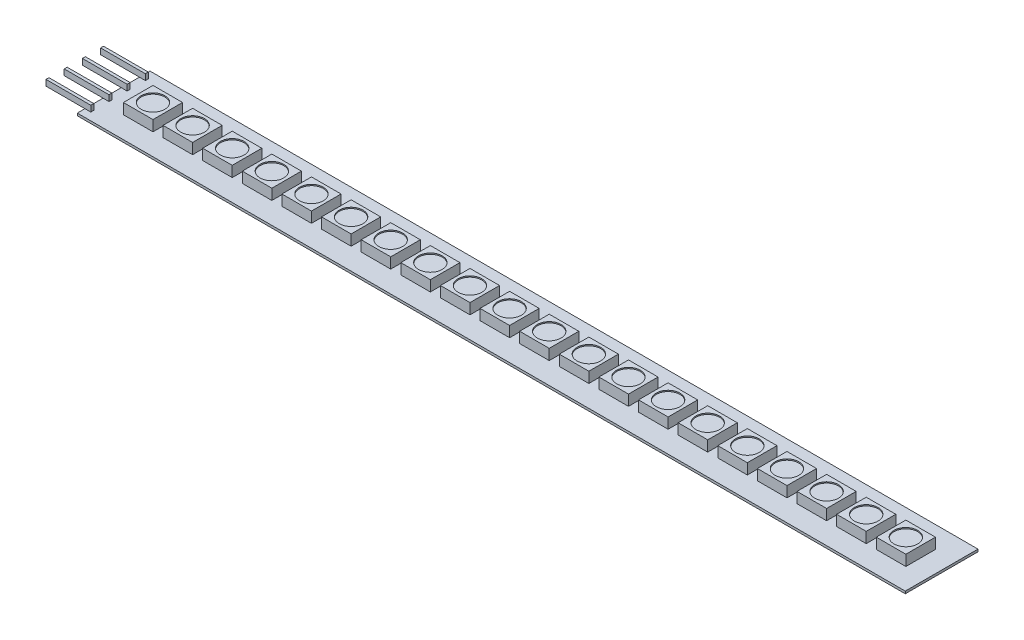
SolidWorks part; units mm, degrees
ref_plane "前基準面" through (0, 0, 0) normal (0, 0, 1) x (1, 0, 0)
ref_plane "上基準面" through (0, 0, 0) normal (0, 1, 0) x (1, 0, 0)
ref_plane "右基準面" through (0, 0, 0) normal (1, 0, 0) x (0, 0, -1)
sketch "草圖1" plane through (0, 0, 0) normal (0, 1, 0) x (1, 0, 0)
  line L1 (0, 0) -> (140, 0)
  line L2 (0, 0) -> (0, 12.3)
  line L3 (0, 12.3) -> (140, 12.3)
  line L4 (140, 0) -> (140, 12.3)
  dimension "D1" = 140
  dimension "D2" = 12.3
extrude "填料-伸長1" add sketch "草圖1" along normal blind 0.4
sketch "草圖2" plane through (0, 0.4, 0) normal (0, 1, 0) x (1, 0, 0)
  line L0 (10, 12.3) -> (10, 0)
  line L1 (140, 12.3) -> (0, 12.3) construction
  line L2 (0, 0) -> (140, 0) construction
  line L3 (0, 12.3) -> (0, 0) construction
  line L4 (16.7, 12.3) -> (16.7, 0)
  line L5 (16.7, 12.3) -> (10, 0) construction
  line L6 (10, 0) -> (10, 12.3) construction
  line L7 (10, 12.3) -> (16.7, 0) construction
  line L8 (9.15, 8.65) -> (4.15, 8.65)
  line L9 (10.85, 3.65) -> (15.85, 3.65)
  line L10 (10.85, 3.65) -> (10.85, 8.65)
  line L11 (10.85, 8.65) -> (15.85, 8.65)
  line L12 (15.85, 3.65) -> (15.85, 8.65)
  line L13 (10.85, 3.65) -> (15.85, 8.65) construction
  line L14 (10.85, 8.65) -> (15.85, 3.65) construction
  line L15 (4.15, 3.65) -> (4.15, 8.65)
  line L16 (9.15, 3.65) -> (4.15, 3.65)
  line L17 (9.15, 3.65) -> (9.15, 8.65)
  line L18 (17.55, 3.65) -> (17.55, 8.65)
  line L19 (17.55, 3.65) -> (22.55, 3.65)
  line L20 (22.55, 3.65) -> (22.55, 8.65)
  line L21 (17.55, 8.65) -> (22.55, 8.65)
  line L22 (23.4, 12.3) -> (23.4, 0)
  line L23 (24.25, 3.65) -> (24.25, 8.65)
  line L24 (24.25, 3.65) -> (29.25, 3.65)
  line L25 (29.25, 3.65) -> (29.25, 8.65)
  line L26 (24.25, 8.65) -> (29.25, 8.65)
  line L27 (30.1, 12.3) -> (30.1, 0)
  line L28 (30.95, 3.65) -> (30.95, 8.65)
  line L29 (30.95, 3.65) -> (35.95, 3.65)
  line L30 (35.95, 3.65) -> (35.95, 8.65)
  line L31 (30.95, 8.65) -> (35.95, 8.65)
  line L32 (36.8, 12.3) -> (36.8, 0)
  line L33 (37.65, 3.65) -> (37.65, 8.65)
  line L34 (37.65, 3.65) -> (42.65, 3.65)
  line L35 (42.65, 3.65) -> (42.65, 8.65)
  line L36 (37.65, 8.65) -> (42.65, 8.65)
  line L37 (43.5, 12.3) -> (43.5, 0)
  line L38 (44.35, 3.65) -> (44.35, 8.65)
  line L39 (44.35, 3.65) -> (49.35, 3.65)
  line L40 (49.35, 3.65) -> (49.35, 8.65)
  line L41 (44.35, 8.65) -> (49.35, 8.65)
  line L42 (50.2, 12.3) -> (50.2, 0)
  line L43 (51.05, 3.65) -> (51.05, 8.65)
  line L44 (51.05, 3.65) -> (56.05, 3.65)
  line L45 (56.05, 3.65) -> (56.05, 8.65)
  line L46 (51.05, 8.65) -> (56.05, 8.65)
  line L47 (56.9, 12.3) -> (56.9, 0)
  line L48 (57.75, 3.65) -> (57.75, 8.65)
  line L49 (57.75, 3.65) -> (62.75, 3.65)
  line L50 (62.75, 3.65) -> (62.75, 8.65)
  line L51 (57.75, 8.65) -> (62.75, 8.65)
  line L52 (63.6, 12.3) -> (63.6, 0)
  line L53 (64.45, 3.65) -> (64.45, 8.65)
  line L54 (64.45, 3.65) -> (69.45, 3.65)
  line L55 (69.45, 3.65) -> (69.45, 8.65)
  line L56 (64.45, 8.65) -> (69.45, 8.65)
  line L57 (70.3, 12.3) -> (70.3, 0)
  line L58 (71.15, 3.65) -> (71.15, 8.65)
  line L59 (71.15, 3.65) -> (76.15, 3.65)
  line L60 (76.15, 3.65) -> (76.15, 8.65)
  line L61 (71.15, 8.65) -> (76.15, 8.65)
  line L62 (77, 12.3) -> (77, 0)
  line L63 (77.85, 3.65) -> (77.85, 8.65)
  line L64 (77.85, 3.65) -> (82.85, 3.65)
  line L65 (82.85, 3.65) -> (82.85, 8.65)
  line L66 (77.85, 8.65) -> (82.85, 8.65)
  line L67 (83.7, 12.3) -> (83.7, 0)
  line L68 (84.55, 3.65) -> (84.55, 8.65)
  line L69 (84.55, 3.65) -> (89.55, 3.65)
  line L70 (89.55, 3.65) -> (89.55, 8.65)
  line L71 (84.55, 8.65) -> (89.55, 8.65)
  line L72 (90.4, 12.3) -> (90.4, 0)
  line L73 (91.25, 3.65) -> (91.25, 8.65)
  line L74 (91.25, 3.65) -> (96.25, 3.65)
  line L75 (96.25, 3.65) -> (96.25, 8.65)
  line L76 (91.25, 8.65) -> (96.25, 8.65)
  line L77 (97.1, 12.3) -> (97.1, 0)
  line L78 (97.95, 3.65) -> (97.95, 8.65)
  line L79 (97.95, 3.65) -> (102.95, 3.65)
  line L80 (102.95, 3.65) -> (102.95, 8.65)
  line L81 (97.95, 8.65) -> (102.95, 8.65)
  line L82 (103.8, 12.3) -> (103.8, 0)
  line L83 (104.65, 3.65) -> (104.65, 8.65)
  line L84 (104.65, 3.65) -> (109.65, 3.65)
  line L85 (109.65, 3.65) -> (109.65, 8.65)
  line L86 (104.65, 8.65) -> (109.65, 8.65)
  line L87 (110.5, 12.3) -> (110.5, 0)
  line L88 (111.35, 3.65) -> (111.35, 8.65)
  line L89 (111.35, 3.65) -> (116.35, 3.65)
  line L90 (116.35, 3.65) -> (116.35, 8.65)
  line L91 (111.35, 8.65) -> (116.35, 8.65)
  line L92 (117.2, 12.3) -> (117.2, 0)
  line L93 (118.05, 3.65) -> (118.05, 8.65)
  line L94 (118.05, 3.65) -> (123.05, 3.65)
  line L95 (123.05, 3.65) -> (123.05, 8.65)
  line L96 (118.05, 8.65) -> (123.05, 8.65)
  line L97 (123.9, 12.3) -> (123.9, 0)
  line L98 (124.75, 3.65) -> (124.75, 8.65)
  line L99 (124.75, 3.65) -> (129.75, 3.65)
  line L100 (129.75, 3.65) -> (129.75, 8.65)
  line L101 (124.75, 8.65) -> (129.75, 8.65)
  line L102 (130.6, 12.3) -> (130.6, 0)
  line L103 (131.45, 3.65) -> (131.45, 8.65)
  line L104 (131.45, 3.65) -> (136.45, 3.65)
  line L105 (136.45, 3.65) -> (136.45, 8.65)
  line L106 (131.45, 8.65) -> (136.45, 8.65)
  line L107 (137.3, 12.3) -> (137.3, 0)
  line L108 (10.85, 3.65) -> (17.55, 3.65) construction
  point P10 (13.35, 6.15)
  dimension "D1" = 10
  dimension "D2" = 6.7
  dimension "D3" = 5
  dimension "D4" = 5
  dimension "D6" = 6.7
  dimension "D5" = 19
extrude "填料-伸長2" add sketch "草圖2" along normal blind 1.8 contours L9 L12 L11 L10 | L21 L18 L19 L20 | L26 L23 L24 L25 | L31 L28 L29 L30 | L36 L33 L34 L35 | L41 L38 L39 L40 | L46 L43 L44 L45 | L51 L48 L49 L50 | L56 L53 L54 L55 | L61 L58 L59 L60 | L66 L63 L64 L65 | L71 L68 L69 L70 | L76 L73 L74 L75 | L81 L78 L79 L80 | L86 L83 L84 L85 | L91 L88 L89 L90 | L96 L93 L94 L95 | L101 L98 L99 L100 | L106 L103 L104 L105 | L15 L8 L17 L16
sketch "草圖3" plane through (0, 2.2, 0) normal (0, 1, 0) x (1, 0, 0)
  line L0 (4.15, 3.65) -> (9.15, 8.65) construction
  line L1 (9.15, 8.65) -> (9.15, 3.65) construction
  line L2 (9.15, 3.65) -> (4.15, 8.65) construction
  line L3 (6.65, 6.15) -> (13.35, 6.15) construction
  circle A0 centre (6.65, 6.15) radius 2
  circle A1 centre (13.35, 6.15) radius 2
  circle A2 centre (20.05, 6.15) radius 2
  circle A3 centre (26.75, 6.15) radius 2
  circle A4 centre (33.45, 6.15) radius 2
  circle A5 centre (40.15, 6.15) radius 2
  circle A6 centre (46.85, 6.15) radius 2
  circle A7 centre (53.55, 6.15) radius 2
  circle A8 centre (60.25, 6.15) radius 2
  circle A9 centre (66.95, 6.15) radius 2
  circle A10 centre (73.65, 6.15) radius 2
  circle A11 centre (80.35, 6.15) radius 2
  circle A12 centre (87.05, 6.15) radius 2
  circle A13 centre (93.75, 6.15) radius 2
  circle A14 centre (100.45, 6.15) radius 2
  circle A15 centre (107.15, 6.15) radius 2
  circle A16 centre (113.85, 6.15) radius 2
  circle A17 centre (120.55, 6.15) radius 2
  circle A18 centre (127.25, 6.15) radius 2
  circle A19 centre (133.95, 6.15) radius 2
  dimension "D1" = 4
  dimension "D3" = 6.7
  dimension "D2" = 20
extrude "除料-伸長1" cut sketch "草圖3" against normal blind 0.2
sketch "草圖4" plane through (0, 0.4, 0) normal (0, 1, 0) x (1, 0, 0)
  line L0 (0, 12.3) -> (0, 0) construction
  line L2 (0, 10.5125) -> (-6.576, 10.5125)
  line L3 (0, 10.5125) -> (0, 11.0125)
  line L4 (0, 11.0125) -> (-6.576, 11.0125)
  line L5 (-6.576, 10.5125) -> (-6.576, 11.0125)
  line L6 (0, 0) -> (0, 3.075)
  line L7 (0, 7.4375) -> (-6.576, 7.4375)
  line L8 (0, 7.4375) -> (0, 7.9375)
  line L9 (0, 7.9375) -> (-6.576, 7.9375)
  line L10 (-6.576, 7.4375) -> (-6.576, 7.9375)
  line L11 (0, 4.8625) -> (-6.576, 4.8625)
  line L12 (0, 4.8625) -> (0, 4.3625)
  line L13 (0, 4.3625) -> (-6.576, 4.3625)
  line L14 (-6.576, 4.8625) -> (-6.576, 4.3625)
  line L15 (0, 1.7875) -> (-6.576, 1.7875)
  line L16 (0, 1.7875) -> (0, 1.2875)
  line L17 (0, 1.2875) -> (-6.576, 1.2875)
  line L18 (-6.576, 1.7875) -> (-6.576, 1.2875)
  line L19 (0, 3.075) -> (0, 6.15)
  line L20 (0, 6.15) -> (0, 9.225)
  line L21 (0, 9.225) -> (0, 12.3)
  line L23 (0, 11.0125) -> (1, 11.0125)
  line L24 (0, 11.0125) -> (0, 10.5125)
  line L25 (0, 10.5125) -> (1, 10.5125)
  line L26 (1, 11.0125) -> (1, 10.5125)
  line L27 (0, 7.9375) -> (1, 7.9375)
  line L28 (0, 7.9375) -> (0, 7.4375)
  line L29 (0, 7.4375) -> (1, 7.4375)
  line L30 (1, 7.9375) -> (1, 7.4375)
  line L31 (0, 4.8625) -> (1, 4.8625)
  line L32 (0, 4.8625) -> (0, 4.3625)
  line L33 (0, 4.3625) -> (1, 4.3625)
  line L34 (1, 4.8625) -> (1, 4.3625)
  line L35 (0, 1.7875) -> (1, 1.7875)
  line L36 (0, 1.7875) -> (0, 1.2875)
  line L37 (0, 1.2875) -> (1, 1.2875)
  line L38 (1, 1.7875) -> (1, 1.2875)
  point P23 (0, 1.5375)
  point P28 (0, 1.5375)
  point P29 (0, 4.6125)
  point P30 (0, 4.6125)
  point P31 (0, 10.7625)
  point P32 (0, 10.7625)
  point P33 (0, 7.6875)
  point P34 (0, 7.6875)
  dimension "D1" = 3.075
  dimension "D2" = 3.075
  dimension "D3" = 0.5
  dimension "D4" = 0.5
  dimension "D5" = 0.5
  dimension "D6" = 0.5
  dimension "D7" = 1
extrude "填料-伸長3" add sketch "草圖4" along normal blind 1 contours L10 L7 L8 L9 | L30 L27 L8 L29 | L5 L2 L3 L4 | L26 L23 L3 L25 | L11 L14 L13 L12 | L34 L31 L12 L33 | L15 L18 L17 L6 | L38 L35 L6 L37
